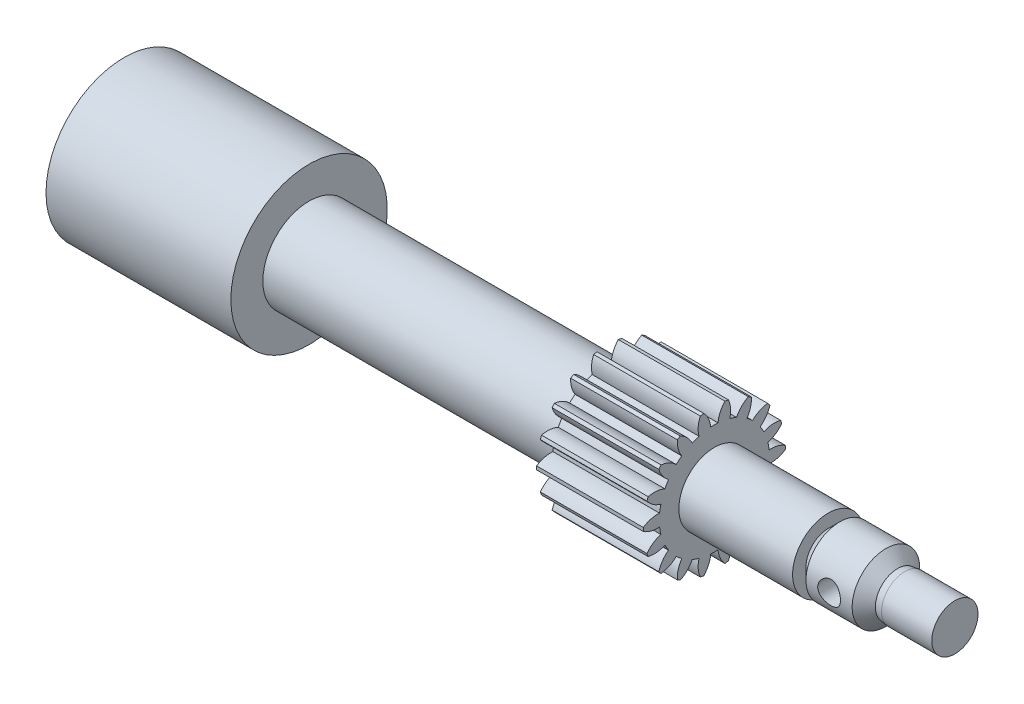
SolidWorks part; units mm, degrees
ref_plane "Plane1" through (0, 0, 0) normal (0, 0, 1) x (1, 0, 0)
ref_plane "Plane2" through (0, 0, 0) normal (0, 1, 0) x (1, 0, 0)
ref_plane "Plane3" through (0, 0, 0) normal (1, 0, 0) x (0, 0, -1)
sketch "HoldingSke" plane through (0, 0, 0) normal (0, 1, 0) x (1, 0, 0)
  line L0 (0, 0) -> (0.9511, -0.309)
  line L1 (-15, 0) -> (100, 0) construction
  line L2 (0, 0) -> (-2.1039, 2.3779)
  line L3 (0, 0) -> (-11.863, 4.5341)
  line L4 (0, 0) -> (8.2133, 2.6687)
  line L5 (0, 0) -> (-46.8476, -17.4728)
  line L6 (0, 0) -> (-12.4344, -8.3896)
  line L7 (-2.1039, 2.3779) -> (8.6586, 51.2059)
  line L8 (-76.2, 54.61) -> (-75.9, 54.61)
  line L9 (-71.009, 38.7566) -> (-53.1078, 45.2721)
  line L10 (-76.2, 71.12) -> (104.1128, 71.12)
  line L11 (0, 0) -> (-15, 0)
  line L12 (-76.2, 101.6) -> (-76.162, 101.6)
  line L13 (24.9733, 27.94) -> (52.9518, 28.4284)
  line L14 (24.9733, 27.94) -> (24.9743, 27.94)
  line L15 (24.9733, 27.94) -> (100.4006, 29.5858)
  line L16 (-63.627, -1) -> (-12.827, -1)
  circle A0 centre (0, 0) radius 1
  circle A1 centre (0, 0) radius 7.749
  circle A2 centre (0, 0) radius 37.5
  circle A3 centre (0, 0) radius 1
  dimension "MHD" = 15.498
  dimension "Hub_dia" = 75
  dimension "Bore" = 2
  dimension "MBD" = 2
  dimension "Num_teeth" = 18
  dimension "Pitch_radius" = 180.3128
  dimension "Pitch" = 1
  dimension "Width" = 15
  dimension "Overall_len" = 50
  dimension "Show_teeth" = 18
  dimension "Thickness" = 15
  dimension "OAL" = 50.0001
  dimension "T_dim" = 0.3
  dimension "Ap" = 20
  dimension "H" = 19.05
  dimension "Backlash" = 0.038
  dimension "Addendum_fac" = 1
  dimension "Dedendum_fac" = 1.25
  dimension "Clearance_fac" = 0.25
  dimension "Dedendum_add" = 0.001
  dimension "Module" = 1
sketch "BasProSke" plane through (0, 0, 0) normal (0, 1, 0) x (1, 0, 0)
  line L0 (-10, 0) -> (60, 0) construction
  line L1 (0, 0) -> (0, 10)
  line L2 (0, 0) -> (15, 0)
  line L3 (15, 0) -> (15, 10)
  line L4 (15, 10) -> (0, 10)
  dimension "Diameter" = 20
  dimension "Thickness" = 15
revolve "Base-Revolve" add sketch "BasProSke" angle 360 about L0
sketch "TooCutSke" plane through (0, 0, 0) normal (1, 0, 0) x (0, 0, -1)
  line L1 (0, 0) -> (0, 107) construction
  line L2 (0, 0) -> (-0.8509, 8.9597) construction
  line L3 (0, 0) -> (-3.1157, 17.6701) construction
  line L4 (-0.8509, 8.9597) -> (-1.5579, 8.835) construction
  arc A0 (0.5106, 7.7322) -> (-0.5106, 7.7322) centre (0, 0) ccw
  arc A1 (1.5152, 9.9102) -> (-1.5152, 9.9102) centre (0, 0) ccw
  circle A2 centre (0, 0) radius 9 construction
  circle A3 centre (0, 0) radius 8.4572 construction
  arc A4 (-0.5106, 7.7322) -> (-1.5152, 9.9102) centre (-4.0952, 7.3996) ccw
  arc A5 (1.5152, 9.9102) -> (0.5106, 7.7322) centre (4.0952, 7.3996) ccw
  dimension "Root_dia" = 15.498
  dimension "Overcut_dia" = 20.0508
  dimension "Pitch_dia" = 18
  dimension "Base_dia" = 16.9145
  dimension "Flank_rad" = 3.6
  dimension "Half_ang" = 10
  dimension "Half_CT" = 0.7179
extrude "ToothCut" cut sketch "TooCutSke" along normal through all
fillet "Breaks" [suppressed] radius 0.02
fillet "RootFillets" [suppressed] radius 0.251
pattern_circular "TeethCuts" count 18 every 20 about axis through (-10, 0, 0) along (1, 0, 0) of "ToothCut", "RootFillets", "Breaks"
sketch "HubNeaOneSke" plane through (0, 0, 0) normal (-1, 0, 0) x (0, 0, 1)
  circle A0 centre (0, 0) radius 7.749
  dimension "Diameter" = 15.498
extrude "HubNearOne" [suppressed] add sketch "HubNeaOneSke" along normal blind 35.0001
sketch "HubNeaBotSke" plane through (0, 0, 0) normal (-1, 0, 0) x (0, 0, 1)
  circle A0 centre (0, 0) radius 7.749
  dimension "Diameter" = 15.498
extrude "HubNearBoth" [suppressed] add sketch "HubNeaBotSke" along normal blind 17.5
ref_plane "FarPln" through (15, 0, 0) normal (1, 0, 0) x (0, 0, -1)
sketch "HubFarSke" plane through (15, 0, 0) normal (1, 0, 0) x (0, 0, -1)
  circle A0 centre (0, 0) radius 7.749
  dimension "Diameter" = 15.498
extrude "HubFar" [suppressed] add sketch "HubFarSke" along normal blind 17.5
sketch "BorSke" plane through (0, 0, 0) normal (1, 0, 0) x (0, 0, -1)
  circle A0 centre (0, 0) radius 1
  dimension "Diameter" = 2
extrude "Bore" cut sketch "BorSke" along normal mid plane 100.0001
sketch "KeySke" plane through (0, 0, 0) normal (1, 0, 0) x (0, 0, -1)
  line L0 (-0.4, 0) -> (-0.4, 1.3)
  line L1 (-0.4, 1.3) -> (0.4, 1.3)
  line L2 (0.4, 1.3) -> (0.4, 0)
  line L3 (0, 0) -> (0, 34) construction
  line L4 (-0.4, 0) -> (0.4, 0)
  dimension "Offset" = 1.3
  dimension "Width" = 0.8
extrude "Keyway" [suppressed] cut sketch "KeySke" along normal mid plane 100.0001
pattern_circular "Keyway2" [suppressed] count 2 every 90 about axis through (-10, 0, 0) along (1, 0, 0)
sketch "Sketch1" plane through (0, 0, 0) normal (0, 1, 0) x (1, 0, 0)
  line L0 (-68, 0) -> (0, 0) construction
  line L2 (-68, 0) -> (-68, 11)
  line L3 (-68, 11) -> (-42, 11)
  line L4 (-42, 11) -> (-42, 6.5)
  line L5 (-42, 6.5) -> (0, 6.5)
  line L6 (0, 6.5) -> (0, 0)
  line L9 (-68, 0) -> (0, 0)
  dimension "D1" = 11
  dimension "D2" = 26
  dimension "D3" = 42
  dimension "D4" = 6.5
revolve "Revolve1" add sketch "Sketch1" angle 360 about L0
sketch "Sketch2" plane through (0, 0, 0) normal (0, 1, 0) x (1, 0, 0)
  line L0 (15, 0) -> (15, 5)
  line L1 (15, 5) -> (31, 5)
  line L2 (31, 5) -> (31, 3.12)
  line L3 (31, 3.12) -> (32.63, 4.75)
  line L4 (39.13, 4.75) -> (40.76, 3.12)
  line L5 (32.63, 4.75) -> (39.13, 4.75)
  line L6 (0, 0) -> (-42, 0) construction
  line L7 (15, -1) -> (15, 1) construction
  line L8 (48.827, 0) -> (48.827, 3.25)
  line L9 (48.827, 0) -> (15, 0)
  line L10 (40.76, 3.12) -> (41.76, 3.25)
  line L11 (41.76, 3.25) -> (48.827, 3.25)
  dimension "D1" = 5
  dimension "D2" = 16
  dimension "D3" = 6.5
  dimension "D4" = 1.63
  dimension "D5" = 4.75
  dimension "D6" = 1.63
  dimension "D7" = 3.25
  dimension "D8" = 1
revolve "Revolve2" add sketch "Sketch2" angle 360 about L9
ref_plane "Plane5" through (0, 0, -4.75) normal (0, 0, -1) x (-1, 0, 0)
sketch "Sketch4" plane through (0, 0, -4.75) normal (0, 0, -1) x (-1, 0, 0)
  line L0 (-32.63, 0) -> (-39.13, 0) construction
  circle A0 centre (-35.88, 0) radius 1.6
  point P8 (-35.88, 0)
  dimension "D1" = 3.2
extrude "Cut-Extrude2" cut sketch "Sketch4" against normal through all
equation "' \"Module@HoldingSke\" = 6.35"
equation "' \"Num_teeth@HoldingSke\" = 12"
equation "' \"Ap@HoldingSke\" =  20"
equation "' \"Width@HoldingSke\" = 0.5 * 25.4"
equation "' \"Hub_dia@HoldingSke\"= 1 * 25.4"
equation "' \"Overall_len@HoldingSke\" = 1.0 * 25.4"
equation "' \"Bore@HoldingSke\" = 0.75 * 25.4"
equation "' \"T_dim@HoldingSke\" = 0.1 * 25.4"
equation "' \"Width@KeySke\" = 0.25 * 25.4"
equation "' \"Show_teeth@HoldingSke\" = 13"
equation "' \"Backlash@HoldingSke\" = 0.009 * 25.4"
equation "' \"Addendum_fac@HoldingSke\" = 1.0"
equation "' \"Dedendum_fac@HoldingSke\" = 1.25"
equation "' \"Dedendum_add@HoldingSke\" = 0.00005 * 25.4"
equation "' \"Clearance_fac@HoldingSke\" = 0.25"
equation "\"Pitch@HoldingSke\" = 1 / \"Module@HoldingSke\""
equation "\"Overcut_dia@TooCutSke\" = (\"Num_teeth@HoldingSke\" + 2 * \"Addendum_fac@HoldingSke\") / \"Pitch@HoldingSke\" + 0.002 * 25.4"
equation "\"Pitch_dia@TooCutSke\" = \"Num_teeth@HoldingSke\" / \"Pitch@HoldingSke\""
equation "\"Base_dia@TooCutSke\" = \"Num_teeth@HoldingSke\" / \"Pitch@HoldingSke\" * cos((\"Ap@HoldingSke\"  * 3.14159265 / 180))"
equation "\"Root_dia@TooCutSke\" = (\"Num_teeth@HoldingSke\" + 2) / \"Pitch@HoldingSke\" - 2 * (\"Addendum_fac@HoldingSke\" + \"Dedendum_fac@HoldingSke\") / \"Pitch@HoldingSke\" - \"Dedendum_add@HoldingSke\" * 2"
equation "\"Half_ang@TooCutSke\" = 180 / \"Num_teeth@HoldingSke\""
equation "\"Half_CT@TooCutSke\" = \"Num_teeth@HoldingSke\" / \"Pitch@HoldingSke\" * sin((3.14159265 / 2 / \"Num_teeth@HoldingSke\")) / 2 - 7 * \"Backlash@HoldingSke\" / 4"
equation "\"Flank_rad@TooCutSke\" = \"Num_teeth@HoldingSke\" / \"Pitch@HoldingSke\" / 5"
equation "\"Radius@RootFillets\" = \"Clearance_fac@HoldingSke\" / \"Pitch@HoldingSke\" + \"Dedendum_add@HoldingSke\""
equation "\"Break_rad@Breaks\" = 0.02 / \"Pitch@HoldingSke\""
equation "\"Thickness@HoldingSke\" = \"Width@HoldingSke\""
equation "\"OAL@HoldingSke\" = \"Thickness@HoldingSke\""
equation "\"MHD@HoldingSke\" = (\"Num_teeth@HoldingSke\" + 2) / \"Pitch@HoldingSke\" - 2 * (\"Addendum_fac@HoldingSke\" + \"Dedendum_fac@HoldingSke\")  / \"Pitch@HoldingSke\" - \"Dedendum_add@HoldingSke\" * 2"
equation "\"MBD@HoldingSke\" = (\"Num_teeth@HoldingSke\" + 2) / \"Pitch@HoldingSke\" - 2 * (\"Addendum_fac@HoldingSke\" + \"Dedendum_fac@HoldingSke\")  / \"Pitch@HoldingSke\" - \"Dedendum_add@HoldingSke\" * 2 - 0.002 * 25.4"
equation "\"MHD@HoldingSke\" = ((sgn( \"MHD@HoldingSke\" - \"Hub_dia@HoldingSke\" )-1)*( \"MHD@HoldingSke\" - \"Hub_dia@HoldingSke\" ))/-2+ \"Hub_dia@HoldingSke\""
equation "\"MBD@HoldingSke\" = ((sgn( \"MBD@HoldingSke\" - \"Bore@HoldingSke\" )-1)*( \"MBD@HoldingSke\" - \"Bore@HoldingSke\" ))/-2+ \"Bore@HoldingSke\""
equation "\"OAL@HoldingSke\" = ((sgn( \"OAL@HoldingSke\" - \"Overall_len@HoldingSke\" )+1)*( \"OAL@HoldingSke\" - \"Overall_len@HoldingSke\" ))/2 + \"Overall_len@HoldingSke\" + 0.000002 * 25.4"
equation "\"Num_teeth@TeethCuts\" = int( \"Show_teeth@HoldingSke\" ) + 1"
equation "\"Num_teeth@TeethCuts\" = ((sgn( \"Num_teeth@TeethCuts\" - \"Num_teeth@HoldingSke\" )-1)*( \"Num_teeth@TeethCuts\" - \"Num_teeth@HoldingSke\" ))/-2+ \"Num_teeth@HoldingSke\""
equation "\"Num_teeth@TeethCuts\" = ((sgn( \"Num_teeth@TeethCuts\" - 2.0)+1)*( \"Num_teeth@TeethCuts\" - 2.0))/2 +2.0"
equation "\"Angle@TeethCuts\" = 360.0 / \"Num_teeth@HoldingSke\""
equation "\"Diameter@BasProSke\" = (\"Num_teeth@HoldingSke\" + 2 * \"Addendum_fac@HoldingSke\") / \"Pitch@HoldingSke\""
equation "\"Thickness@BasProSke\"  = \"Thickness@HoldingSke\""
equation "' \"Fillet_rad@BasProSke\" =  \"Thickness@HoldingSke\" * 0.05"
equation "\"MHD@HoldingSke\" = ((sgn( \"MHD@HoldingSke\" - \"Root_dia@TooCutSke\" )-1)*( \"MHD@HoldingSke\" - \"Root_dia@TooCutSke\" ))/-2+ \"Root_dia@TooCutSke\""
equation "\"Diameter@HubNeaOneSke\" = \"MHD@HoldingSke\""
equation "\"Length@HubNearOne\" = \"OAL@HoldingSke\" - \"Thickness@BasProSke\""
equation "\"Diameter@HubNeaBotSke\" = \"MHD@HoldingSke\""
equation "\"Length@HubNearBoth\" = ( \"OAL@HoldingSke\" - \"Thickness@BasProSke\" ) / 2.0"
equation "\"Thickness@FarPln\" = \"Thickness@BasProSke\""
equation "\"Diameter@HubFarSke\" = \"MHD@HoldingSke\""
equation "\"Length@HubFar\" = ( \"OAL@HoldingSke\" - \"Thickness@BasProSke\" ) / 2.0"
equation "\"Diameter@BorSke\" = \"MBD@HoldingSke\""
equation "\"D1@Bore\" = \"OAL@HoldingSke\" * 2.0"
equation "\"D1@Keyway\" = \"OAL@HoldingSke\" * 2.0"
equation "\"Offset@KeySke\" = \"T_dim@HoldingSke\" + \"MBD@HoldingSke\" / 2.0"
